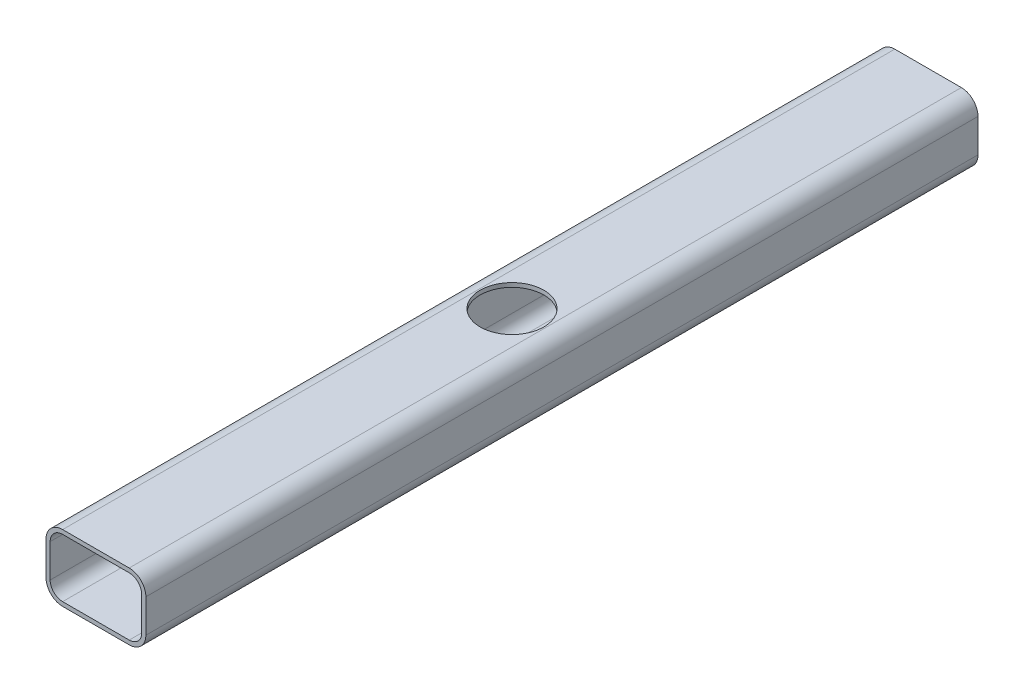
SolidWorks part; units mm, degrees
ref_plane "Plane1" through (0, 0, 0) normal (0, 0, 1) x (1, 0, 0)
ref_plane "Plane2" through (0, 0, 0) normal (0, 1, 0) x (1, 0, 0)
ref_plane "Plane3" through (0, 0, 0) normal (1, 0, 0) x (0, 0, -1)
sketch "Sketch1"
  dimension "D1" = 12.7
  dimension "D2" = 12.7
  dimension "D3" = 12.7
  dimension "D4" = 12.7
  dimension "D5" = 76.2
  dimension "D6" = 50.8
  dimension "D7" = 165.1
extrude "Base-Extrude-Thin" add sketch "Sketch1" along normal mid plane 635 thin
sketch "Sketch2"
extrude "Cut-Extrude1" cut sketch "Sketch2" against normal through all
